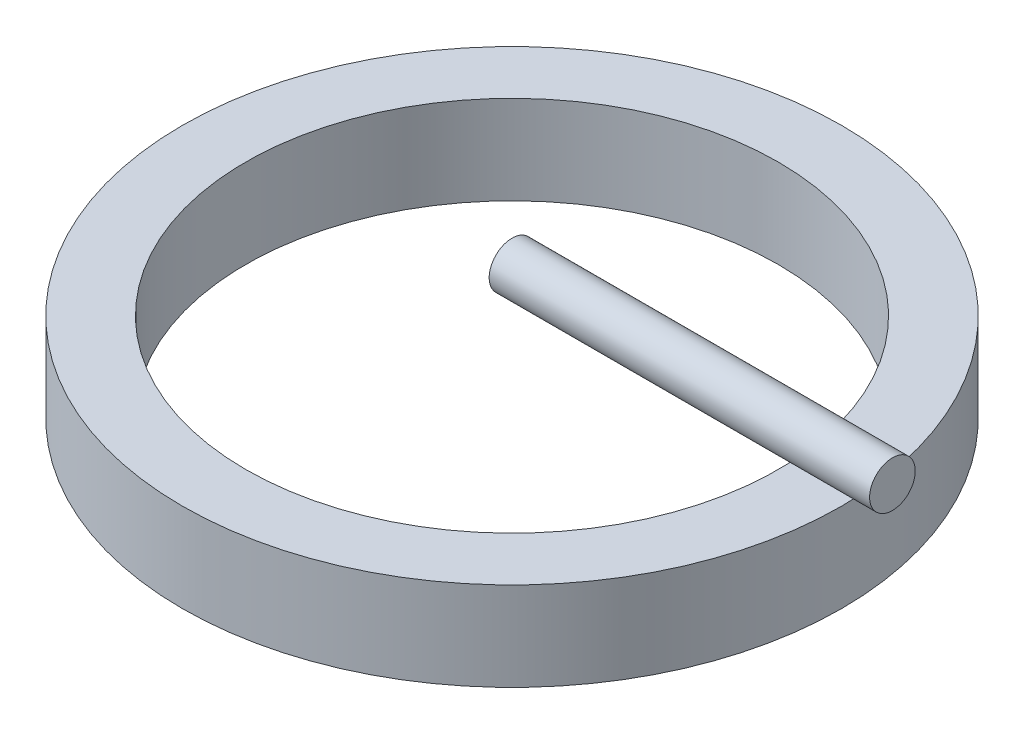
SolidWorks part; units mm, degrees
ref_plane "Front Plane" through (0, 0, 0) normal (0, 0, 1) x (1, 0, 0)
ref_plane "Top Plane" through (0, 0, 0) normal (0, 1, 0) x (1, 0, 0)
ref_plane "Right Plane" through (0, 0, 0) normal (1, 0, 0) x (0, 0, -1)
sketch "Sketch1" plane through (0, 0, 0) normal (0, 1, 0) x (1, 0, 0)
  circle A0 centre (0, 0) radius 13000
  circle A1 centre (0, 0) radius 10500
extrude "Boss-Extrude1" add sketch "Sketch1" against normal blind 3500
sketch "Sketch2" plane through (0, 0, 0) normal (1, 0, 0) x (0, 0, -1)
  circle A0 centre (0, 1750) radius 900
extrude "Boss-Extrude2" add sketch "Sketch2" along normal blind 15000
